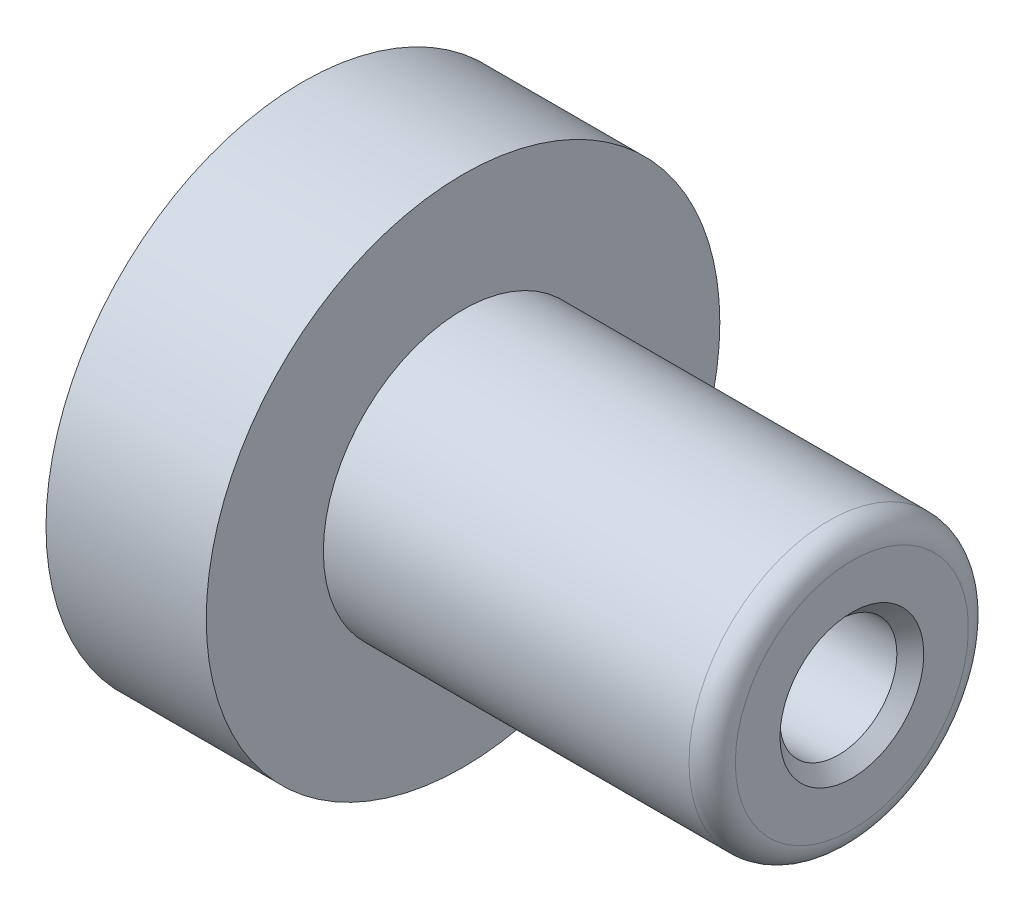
SolidWorks part; units mm, degrees
ref_plane "Front Plane" through (0, 0, 0) normal (0, 0, 1) x (1, 0, 0)
ref_plane "Top Plane" through (0, 0, 0) normal (0, 1, 0) x (1, 0, 0)
ref_plane "Right Plane" through (0, 0, 0) normal (1, 0, 0) x (0, 0, -1)
sketch "Sketch1" plane through (0, 0, 0) normal (0, 0, 1) x (1, 0, 0)
  line L0 (0, 0) -> (102.3864, 0) construction
  line L1 (0, 6.7437) -> (0, 17.4625)
  line L2 (0, 17.4625) -> (10.8966, 17.4625)
  line L3 (10.8966, 17.4625) -> (10.8966, 9.4996)
  line L4 (10.8966, 9.4996) -> (35.7632, 9.4996)
  line L5 (37.338, 7.9248) -> (37.338, 0)
  line L6 (37.338, 0) -> (20.447, 0)
  line L7 (0, 6.7437) -> (20.447, 6.7437)
  line L8 (20.447, 6.7437) -> (20.447, 0)
  arc A0 (37.338, 7.9248) -> (35.7632, 9.4996) centre (35.7632, 7.9248) ccw
  dimension "D5" = 1.5748
  dimension "D1" = 10.8966
  dimension "D2" = 34.925
  dimension "D3" = 20.447
  dimension "D4" = 13.4874
  dimension "D6" = 37.338
  dimension "D7" = 18.9992
revolve "Revolve1" add sketch "Sketch1" angle 360 about L0
sketch "Sketch2" plane through (0, 0, 0) normal (-1, 0, 0) x (0, 0, 1)
  line L0 (0, 0) -> (0, 9.7644) construction
  circle A0 centre (-11.1125, 0) radius 1.6129
  circle A1 centre (11.1125, 0) radius 1.6129
  dimension "D2" = 3.2258
  dimension "D1" = 22.225
extrude "Cut-Extrude1" cut sketch "Sketch2" against normal blind 6.35
sketch "Sketch3" plane through (37.338, 0, 0) normal (1, 0, 0) x (0, 0, -1)
  circle A0 centre (0, 0) radius 3.9751
  dimension "D1" = 7.9502
extrude "Cut-Extrude2" cut sketch "Sketch3" against normal through all
chamfer "Chamfer1" distance 0.9144 angle 45 1 edges at (37.338, 0, -3.9751)
